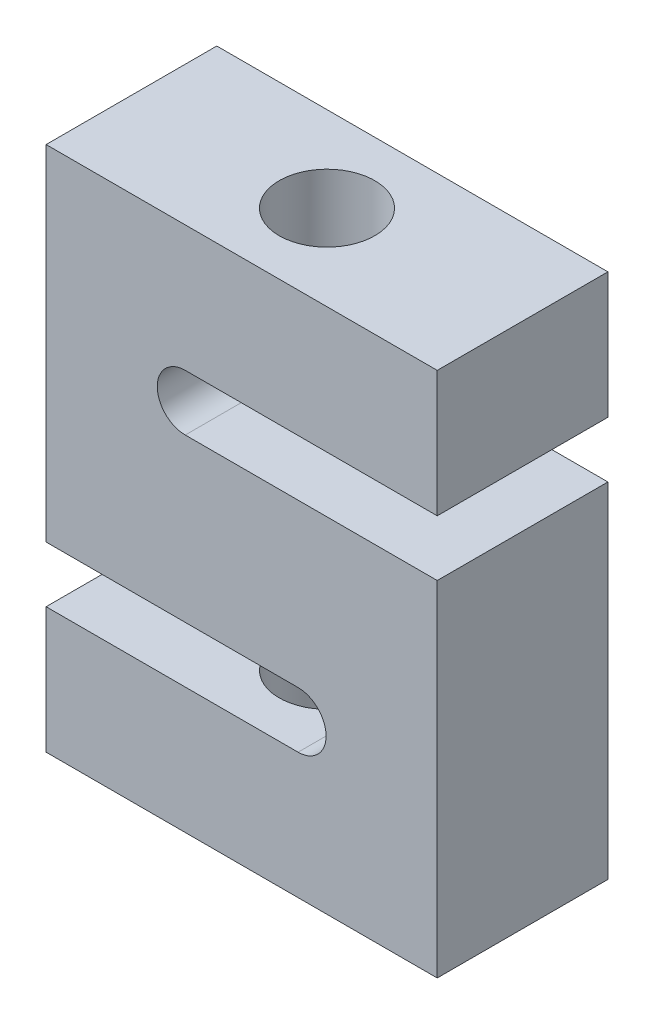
SolidWorks part; units mm, degrees
ref_plane "Front" through (0, 0, 0) normal (0, 0, 1) x (1, 0, 0)
ref_plane "Top" through (0, 0, 0) normal (0, 1, 0) x (1, 0, 0)
ref_plane "Right" through (0, 0, 0) normal (1, 0, 0) x (0, 0, -1)
sketch "Sketch2" plane through (0, 0, 0) normal (0, 0, 1) x (1, 0, 0)
  line L0 (-115.7484, 0) -> (180.4341, 0) construction
  line L1 (-69.85, 93.98) -> (69.85, 93.98)
  line L2 (-69.85, 93.98) -> (-69.85, -28.98)
  line L3 (-69.85, -93.98) -> (69.85, -93.98)
  line L4 (69.85, 93.98) -> (69.85, 48.98)
  line L5 (-69.85, 93.98) -> (69.85, -93.98) construction
  line L6 (-69.85, -93.98) -> (69.85, 93.98) construction
  line L7 (69.85, 48.98) -> (-20.15, 48.98)
  line L8 (-69.85, -28.98) -> (20.15, -28.98)
  line L9 (69.85, 28.98) -> (-20.15, 28.98)
  line L10 (-20.15, 48.98) -> (-20.15, 28.98) construction
  line L11 (69.85, 48.98) -> (-20.15, 28.98) construction
  line L12 (69.85, 28.98) -> (-20.15, 48.98) construction
  line L13 (69.85, 28.98) -> (69.85, -93.98)
  line L14 (20.15, -28.98) -> (20.15, -48.98) construction
  line L15 (20.15, -48.98) -> (-69.85, -48.98)
  line L16 (-69.85, -48.98) -> (-69.85, -93.98)
  arc A0 (-20.15, 48.98) -> (-20.15, 28.98) centre (-20.15, 38.98) ccw
  arc A1 (20.15, -48.98) -> (20.15, -28.98) centre (20.15, -38.98) ccw
  point P0 (0, 0)
  point P10 (24.85, 38.98)
  dimension "D1" = 139.7
  dimension "D2" = 187.96
  dimension "D3" = 45
  dimension "D4" = 20
  dimension "D5" = 90
  dimension "D6" = 90
  dimension "D7" = 45
  dimension "D8" = 20
extrude "Boss-Extrude1" add sketch "Sketch2" along normal mid plane 60.96
hole_wizard "1-1/2-6 Tapped Hole1" positions "Sketch3" profile "Sketch4" tap size "1-1/2-6" standard "ANSI Inch"
sketch "Sketch3" plane through (0, 93.98, 0) normal (0, 1, 0) x (1, 0, 0)
  point P0 (0, 0)
sketch "Sketch4" plane through (0, 93.98, 0) normal (1, 0, 0) x (0, 0, 1)
  line L0 (0, 0) -> (0, 122.96)
  line L1 (0, 122.96) -> (17.0663, 122.96)
  line L2 (17.0663, 122.96) -> (17.0663, 0)
  line L5 (17.0663, 0) -> (0, 0)
  line L11 (0, -6.35) -> (0, 107.95) construction
  dimension "Thru Tap Drill Dia." = 34.1325
  dimension "Thru Tap Drill Depth" = 122.96
mirror "Mirror1" about plane through (0, 0, 0) normal (0, 1, 0) of "1-1/2-6 Tapped Hole1"
